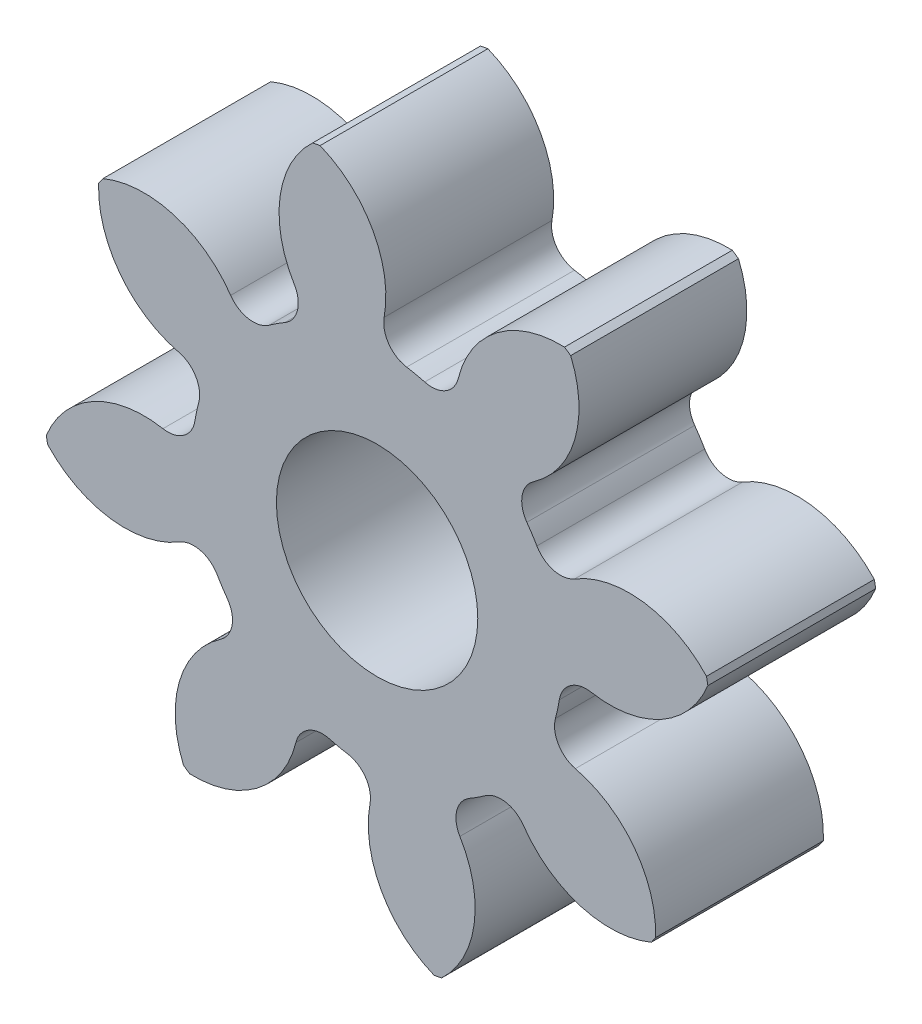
SolidWorks part; units mm, degrees
ref_plane "Front" through (0, 0, 0) normal (0, 0, 1) x (1, 0, 0)
ref_plane "Top" through (0, 0, 0) normal (0, 1, 0) x (1, 0, 0)
ref_plane "Right" through (0, 0, 0) normal (1, 0, 0) x (0, 0, -1)
sketch "Sketch3" plane through (0, 0, 0) normal (0, 0, 1) x (1, 0, 0)
  circle A0 centre (0, 0) radius 254
  dimension "od" = 508
extrude "gearBody" add sketch "Sketch3" along normal blind 127
sketch "Sketch2" plane through (0, 0, 0) normal (0, 0, 1) x (1, 0, 0)
  line L0 (0, 0) -> (176.4107, 73.0717) construction
  line L1 (209.357, -153.8818) -> (0, 0) construction
  line L2 (0, 0) -> (36.3143, 0) construction
  line L3 (203.1899, -2.0274) -> (186.2219, -81.3121) construction
  line L5 (194.7059, -41.6697) -> (0, 0) construction
  line L7 (0, 0) -> (190.9455, 0) construction
  arc A0 (190.8709, -5.3368) -> (176.3365, -73.2506) centre (0, 0) ccw construction
  arc A1 (250.3097, 43.1397) -> (210.7284, -141.8082) centre (0, 0) ccw construction
  arc A2 (203.1899, -2.0274) -> (186.2219, -81.3121) centre (0, 0) ccw construction
  arc A3 (134.9761, -36.0215) -> (137.8962, -22.3769) centre (0, 0) ccw
  arc A4 (209.357, -153.8818) -> (150.0309, -61.4339) centre (131.0516, -138.8729) ccw
  arc A5 (209.357, -153.8818) -> (254, 54.717) centre (0, 0) ccw
  arc A6 (254, 54.717) -> (162.0332, -5.3521) centre (176.4107, 73.0717) cw
  arc A7 (137.8962, -22.3769) -> (162.0332, -5.3521) centre (158.3048, -25.6887) cw
  arc A8 (150.0309, -61.4339) -> (134.9761, -36.0215) centre (154.9525, -41.3527) cw
  point P6 (254, 54.717)
  point P22 (209.357, -153.8818)
  dimension "baseDia" = 381.8911
  dimension "od" = 508
  dimension "pd" = 406.4
  dimension "rd" = 279.4
  dimension "rFillet" = 20.6756
  dimension "pointX" = 254
  dimension "pointY" = 54.717
  dimension "CTT" = 79.2847
  dimension "flankCenterAngle" = 22.5
extrude "toothCut" cut sketch "Sketch2" along normal through all
pattern_circular "CirPattern1" count 8 over 360 about axis through (0, 0, 0) along (0, 0, 1) of "toothCut"
sketch "hub1Dia" plane through (0, 0, 0) normal (0, 0, -1) x (-1, 0, 0)
  circle A0 centre (0, 0) radius 12.7
  dimension "hub1Dia" = 25.4
sketch "hub2Dia" plane through (0, 0, 127) normal (0, 0, 1) x (1, 0, 0)
  circle A0 centre (0, 0) radius 12.7
  dimension "hub2dia" = 25.4
sketch "boreDia" plane through (0, 0, 0) normal (0, 0, 1) x (1, 0, 0)
  circle A0 centre (0, 0) radius 76.2
  dimension "boreDia" = 152.4
extrude "bore" cut sketch "boreDia" against normal mid plane 25400
